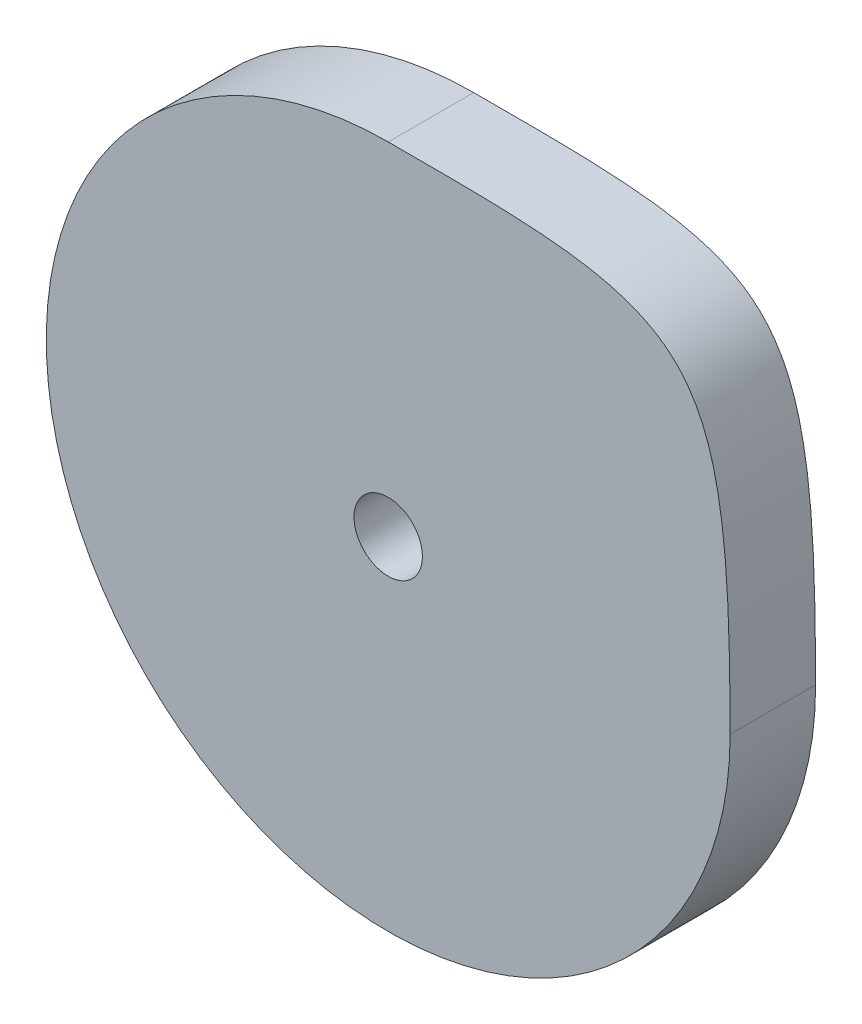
SolidWorks part; units mm, degrees
ref_plane "Front Plane" through (0, 0, 0) normal (0, 0, 1) x (1, 0, 0)
ref_plane "Top Plane" through (0, 0, 0) normal (0, 1, 0) x (1, 0, 0)
ref_plane "Right Plane" through (0, 0, 0) normal (1, 0, 0) x (0, 0, -1)
sketch "Sketch1" plane through (0, 0, 0) normal (0, 0, 1) x (1, 0, 0)
  arc A0 (0, 40) -> (40, 0) centre (0, 0) ccw
  circle A1 centre (0, 0) radius 4
  spline S0 degree 3 poles (0, 40) (14.1486, 40) (37.3343, 40.2598) (40, 22.2919) (40, 0) knots 0 0 0 0 0.453024 1 1 1 1
extrude "Boss-Extrude1" add sketch "Sketch1" along normal blind 10
